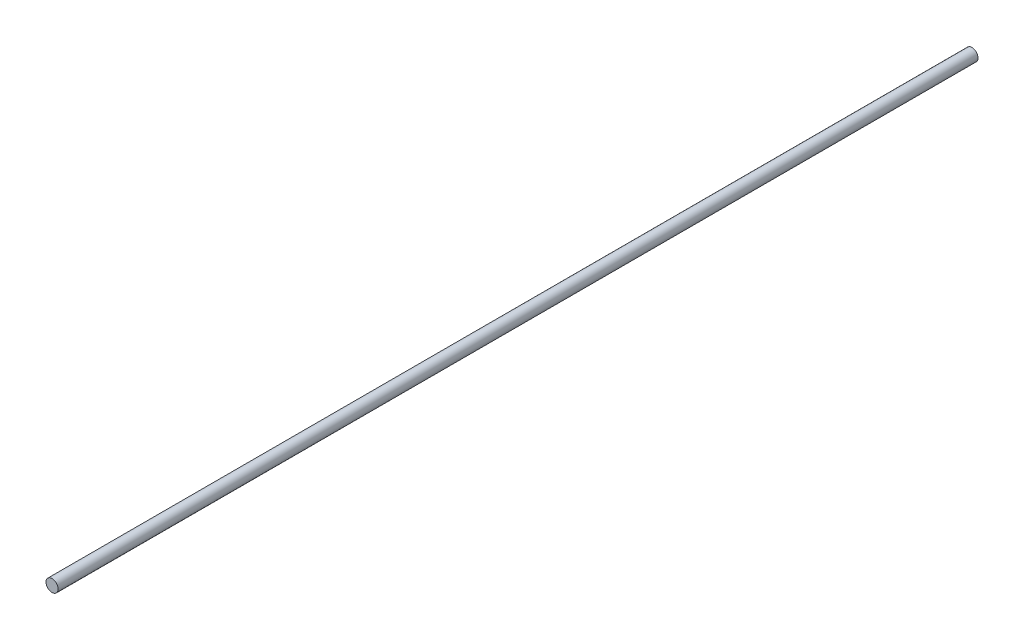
SolidWorks part; units mm, degrees
ref_plane "Front Plane" through (0, 0, 0) normal (0, 0, 1) x (1, 0, 0)
ref_plane "Top Plane" through (0, 0, 0) normal (0, 1, 0) x (1, 0, 0)
ref_plane "Right Plane" through (0, 0, 0) normal (1, 0, 0) x (0, 0, -1)
sketch "Sketch1" plane through (0, 0, 0) normal (0, 0, 1) x (1, 0, 0)
  circle A0 centre (0, 0) radius 30
  dimension "D1" = 60
extrude "Boss-Extrude1" add sketch "Sketch1" against normal blind 4550
